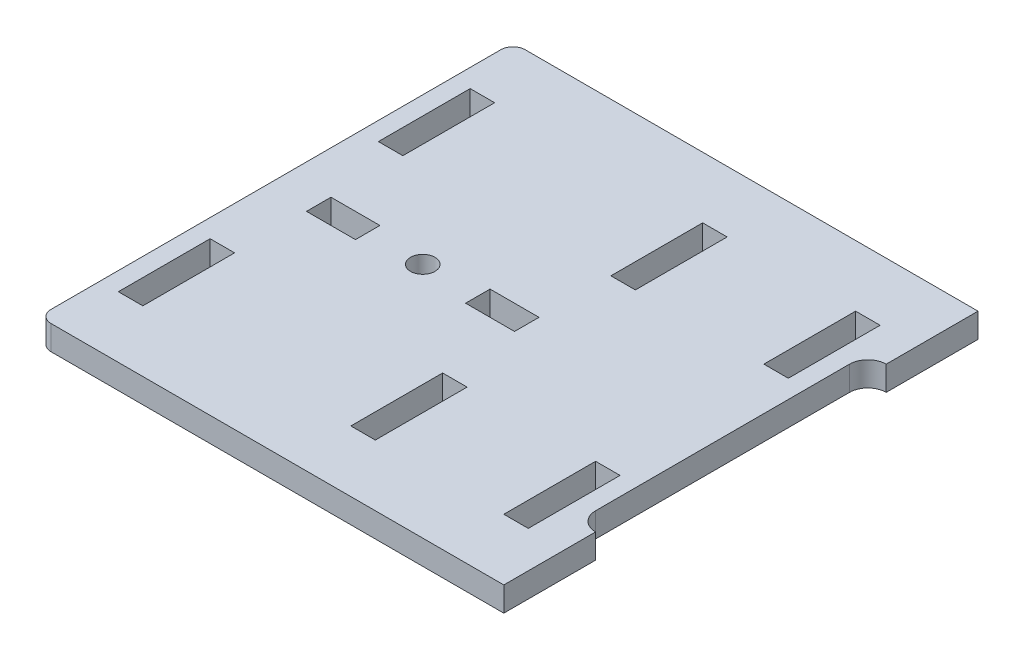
SolidWorks part; units mm, degrees
ref_plane "Ebene vorne" through (0, 0, 0) normal (0, 0, 1) x (1, 0, 0)
ref_plane "Ebene oben" through (0, 0, 0) normal (0, 1, 0) x (1, 0, 0)
ref_plane "Ebene rechts" through (0, 0, 0) normal (1, 0, 0) x (0, 0, -1)
sketch "Skizze2" plane through (0, 0, 0) normal (0, 1, 0) x (1, 0, 0)
  line L0 (-74.6062, 0) -> (112.5525, 0) construction
  line L1 (0, 76.8215) -> (0, -83.6429) construction
  line L2 (35, 20.75) -> (35, -20.75)
  line L3 (-36, 38.75) -> (38, 38.75)
  line L4 (-38, 36.75) -> (-38, -36.75)
  line L5 (-36, -38.75) -> (38, -38.75)
  line L6 (38, 38.75) -> (38, 23.75)
  line L7 (38, -38.75) -> (38, -23.75)
  line L8 (3, 28.75) -> (7, 28.75)
  line L9 (-35, 28.75) -> (-31, 28.75)
  line L10 (-35, 28.75) -> (-35, 13.75)
  line L11 (-35, 13.75) -> (-31, 13.75)
  line L12 (-31, 28.75) -> (-31, 13.75)
  line L13 (3, 28.75) -> (3, 13.75)
  line L14 (3, 13.75) -> (7, 13.75)
  line L15 (7, 28.75) -> (7, 13.75)
  line L16 (28, 28.75) -> (32, 28.75)
  line L17 (28, 28.75) -> (28, 13.75)
  line L18 (28, 13.75) -> (32, 13.75)
  line L19 (32, 28.75) -> (32, 13.75)
  line L20 (32, -28.75) -> (32, -13.75)
  line L21 (28, -13.75) -> (32, -13.75)
  line L22 (28, -28.75) -> (28, -13.75)
  line L23 (28, -28.75) -> (32, -28.75)
  line L24 (7, -28.75) -> (7, -13.75)
  line L25 (3, -13.75) -> (7, -13.75)
  line L26 (3, -28.75) -> (3, -13.75)
  line L27 (-31, -28.75) -> (-31, -13.75)
  line L28 (-35, -13.75) -> (-31, -13.75)
  line L29 (-35, -28.75) -> (-35, -13.75)
  line L30 (-35, -28.75) -> (-31, -28.75)
  line L31 (3, -28.75) -> (7, -28.75)
  line L33 (-31, 2) -> (-23, 2)
  line L34 (-31, 2) -> (-31, -2)
  line L35 (-31, -2) -> (-23, -2)
  line L36 (-23, 2) -> (-23, -2)
  line L37 (-5, 2) -> (3, 2)
  line L38 (-5, 2) -> (-5, -2)
  line L39 (-5, -2) -> (3, -2)
  line L40 (3, 2) -> (3, -2)
  arc A0 (38, 23.75) -> (35, 20.75) centre (38, 20.75) ccw
  arc A1 (38, -23.75) -> (35, -20.75) centre (38, -20.75) cw
  circle A2 centre (-14, 0) radius 2
  arc A3 (-38, 36.75) -> (-36, 38.75) centre (-36, 36.75) cw
  arc A4 (-38, -36.75) -> (-36, -38.75) centre (-36, -36.75) ccw
  point P16 (35, 0)
  point P52 (-5, -1.1193)
  point P53 (-38, 38.75)
  dimension "D3" = 3
  dimension "D5" = 4
  dimension "D20" = 4
  dimension "D10" = 2
  dimension "D1" = 76
  dimension "D2" = 77.5
  dimension "D4" = 15
  dimension "D6" = 10
  dimension "D7" = 15
  dimension "D8" = 3
  dimension "D9" = 4
  dimension "D11" = 25
  dimension "D12" = 3
  dimension "D13" = 4
  dimension "D15" = 34
  dimension "D16" = 4
  dimension "D17" = 8
  dimension "D18" = 4
  dimension "D19" = 8
  dimension "D21" = 9
extrude "Aufsatz-Linear austragen1" add sketch "Skizze2" along normal blind 4
